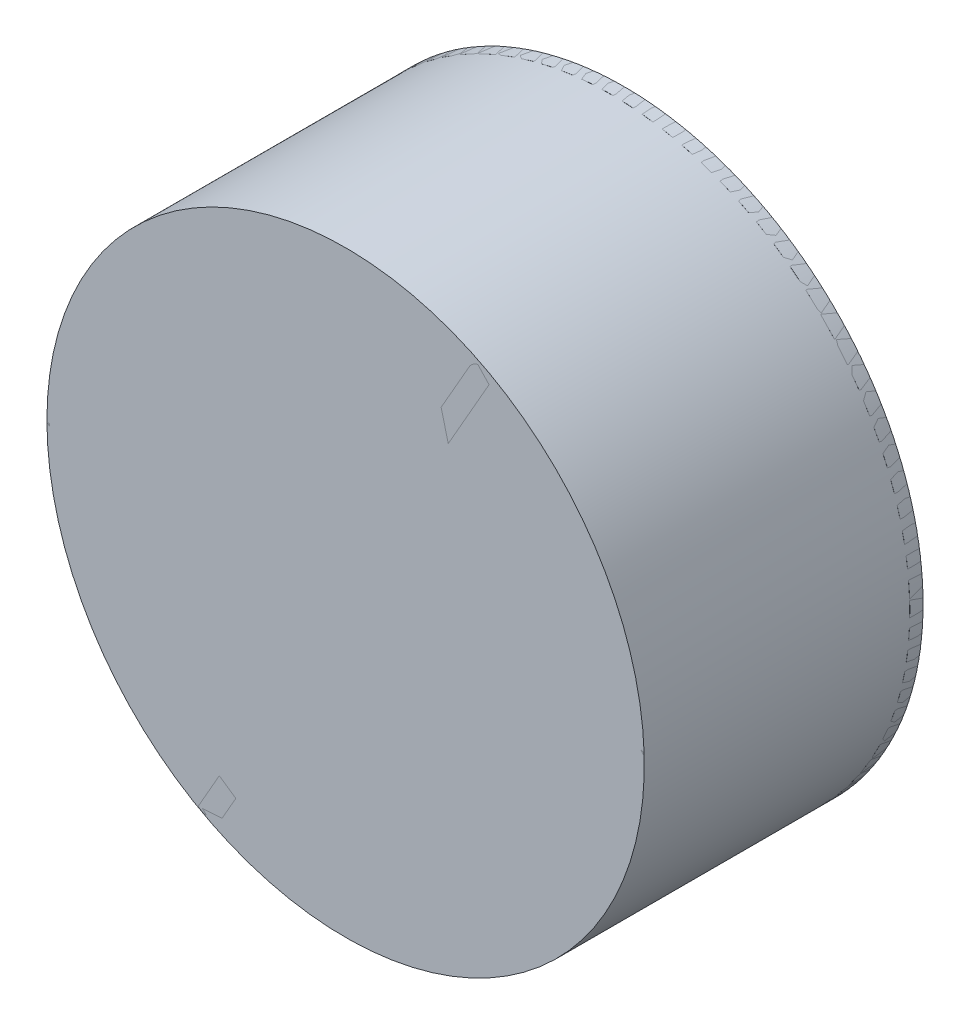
SolidWorks part; units mm, degrees
ref_plane "Front Plane" through (0, 0, 0) normal (0, 0, 1) x (1, 0, 0)
ref_plane "Top Plane" through (0, 0, 0) normal (0, 1, 0) x (1, 0, 0)
ref_plane "Right Plane" through (0, 0, 0) normal (1, 0, 0) x (0, 0, -1)
ref_plane "Plane1" through (0, 0, -1.5) normal (0, 0, 1) x (1, 0, 0)
sketch "Sketch1" plane through (0, 0, 0) normal (0, 0, 1) x (1, 0, 0)
  circle A0 centre (0, 0) radius 22.5
  dimension "D1" = 45
extrude "Boss-Extrude1" add sketch "Sketch1" against normal blind 1
sketch "Sketch4" plane through (0, 0, 0) normal (0, 0, 1) x (1, 0, 0)
  circle A0 centre (0, 0) radius 1.15
  dimension "D1" = 2.3
extrude "Cut-Extrude1" cut sketch "Sketch4" against normal through all
sketch "Sketch6" plane through (0, 0, 0) normal (0, 0, 1) x (1, 0, 0)
  circle A0 centre (0, 0) radius 1
  circle A2 centre (0, 0) radius 2
  dimension "D1" = 2
  dimension "D2" = 4
extrude "Boss-Extrude3" add sketch "Sketch6" along normal blind 6
sketch "Sketch7" plane through (0, 0, 0) normal (0, 0, 1) x (1, 0, 0)
  line L0 (0, 0) -> (9.1346, 0) construction
  line L1 (20.5634, 0.1288) -> (8.109, 0.1288) construction
  line L2 (9.1346, 1.5) -> (9.1346, 0)
  line L3 (22.441, 0.1288) -> (22.441, 1.6288)
  line L4 (13.5362, 0) -> (8.526, 0) construction
  line L5 (3.85, 0) -> (-3.85, 0) construction
  line L6 (0, 0) -> (38.2985, 0) construction
  line L7 (29.9387, 0.1288) -> (14.2668, 0.1288) construction
  circle A3 centre (0, 0) radius 22.5 construction
  spline S0 degree 3 poles (9.1346, 0) (13.6141, 0) (12.6461, 0.1288) (22.441, 0.1288) knots 0 0 0 0 0.864172 0.864172 0.864172 0.864172
  spline S1 degree 1 poles (9.1346, 1.5) (22.441, 1.6288) knots 0 0 1 1 construction
  spline S2 degree 3 poles (9.1346, 1.5) (9.3927, 1.5) (9.9353, 1.501) (10.8082, 1.5065) (11.7225, 1.5189) (12.6845, 1.5398) (13.7208, 1.564) (15.0117, 1.5884) (16.4532, 1.6061) (17.9205, 1.6172) (19.2, 1.6236) (20.4411, 1.6271) (21.5378, 1.6285) (22.1448, 1.6288) (22.441, 1.6288) knots 0 0 0 0 0.054011 0.108021 0.216043 0.324064 0.432086 0.540107 0.648129 0.70214 0.75615 0.810161 0.837166 0.864172 0.864172 0.864172 0.864172
  point P7 (22.441, 1.6288)
  dimension "D2" = 1.5
extrude "Boss-Extrude5" add sketch "Sketch7" along normal blind 20
fillet "Fillet1" radius 1 1 edges at (9.1346, 1.5, 10)
fillet "Fillet2" radius 1 1 edges at (22.441, 1.6288, 10)
pattern_circular "CirPattern3" count 6 over 360 about axis through (0, 0, 6) along (0, 0, 1) of "Fillet1", "Boss-Extrude5", "Fillet2"
fillet "Fillet4" radius 1 2 edges at (2, 0, 0) (2, 0, 6)
sketch "Sketch11" plane through (0, 0, -1.5) normal (0, 0, 1) x (1, 0, 0)
  circle A0 centre (0, 0) radius 17.5
  dimension "D1" = 35
extrude "Boss-Extrude10" add sketch "Sketch11" along normal blind 19 separate body contours A0
sketch "Sketch12" plane through (0, 0, -1) normal (0, 0, -1) x (-1, 0, 0)
  circle A0 centre (0, 0) radius 22.5
extrude "Boss-Extrude11" add sketch "Sketch12" against normal blind 21 separate body
